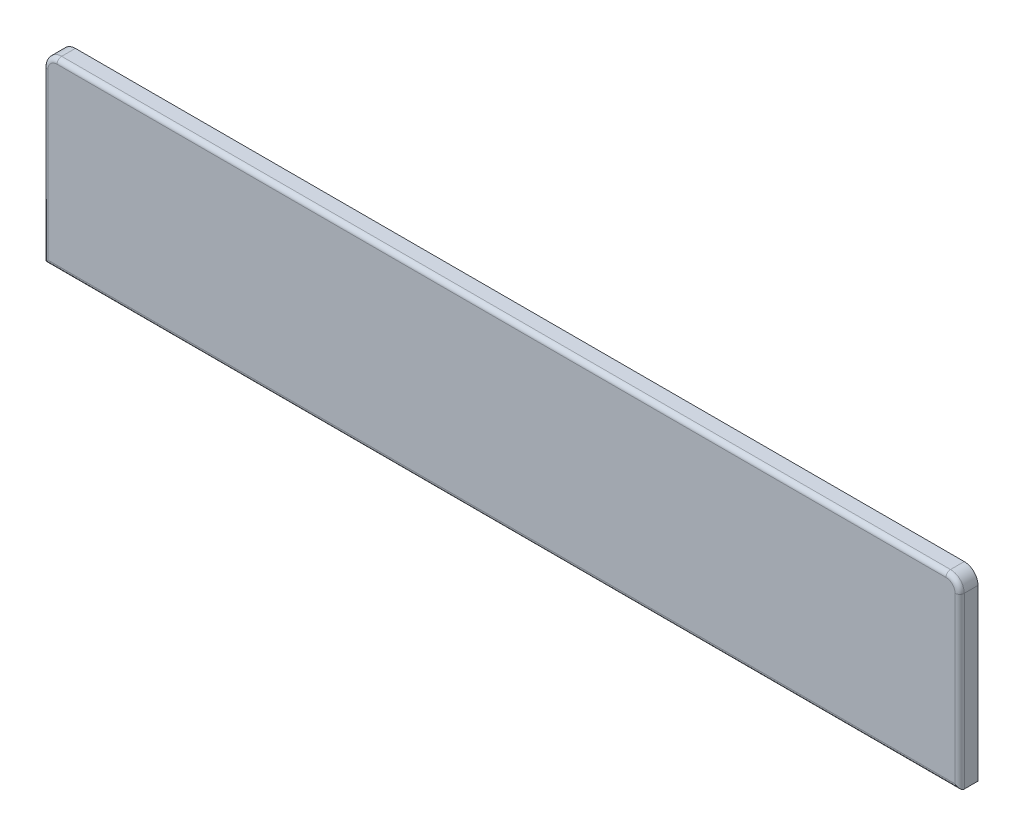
SolidWorks part; units mm, degrees
ref_plane "Спереди" through (0, 0, 0) normal (0, 0, 1) x (1, 0, 0)
ref_plane "Сверху" through (0, 0, 0) normal (0, 1, 0) x (1, 0, 0)
ref_plane "Справа" through (0, 0, 0) normal (1, 0, 0) x (0, 0, -1)
sketch "Эскиз1" plane through (0, 0, 0) normal (0, 0, 1) x (1, 0, 0)
  line L1 (0, 0) -> (-2000, 0)
  line L2 (0, 0) -> (0, -400)
  line L3 (0, -400) -> (-2000, -400)
  line L4 (-2000, 0) -> (-2000, -400)
  dimension "D1" = 2000
  dimension "D2" = 400
extrude "Бобышка-Вытянуть1" add sketch "Эскиз1" along normal blind 40
fillet "Скругление2" radius 30 2 edges at (0, 0, 20) (-2000, 0, 20)
fillet "Скругление3" radius 10 6 edges at (-1000, -400, 40) (-2000, -215, 40) (-1991.2132, -8.7868, 40) (-1000, 0, 40) (-8.7868, -8.7868, 40) (0, -215, 40)
